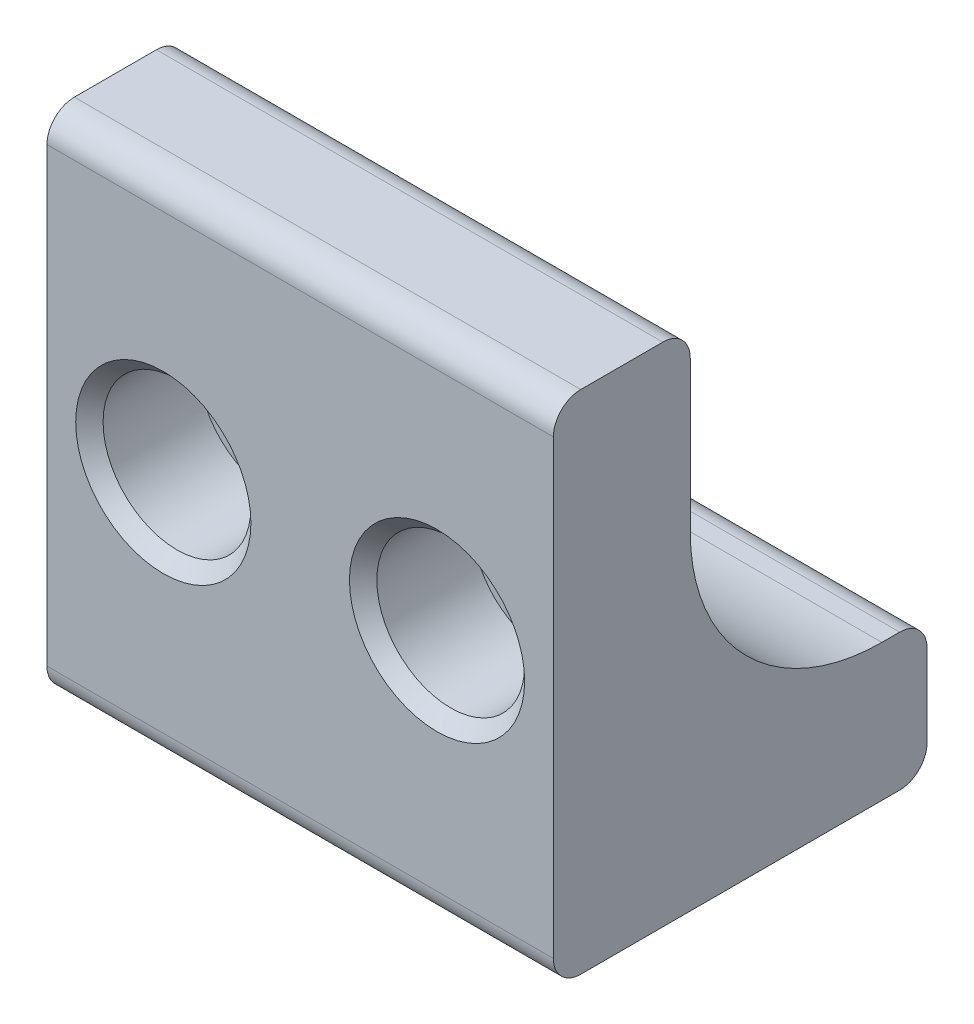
SolidWorks part; units mm, degrees
ref_plane "Front Plane" through (0, 0, 0) normal (0, 0, 1) x (1, 0, 0)
ref_plane "Top Plane" through (0, 0, 0) normal (0, 1, 0) x (1, 0, 0)
ref_plane "Right Plane" through (0, 0, 0) normal (1, 0, 0) x (0, 0, -1)
body saved out of another part "Stock-Internal Volume-1"
